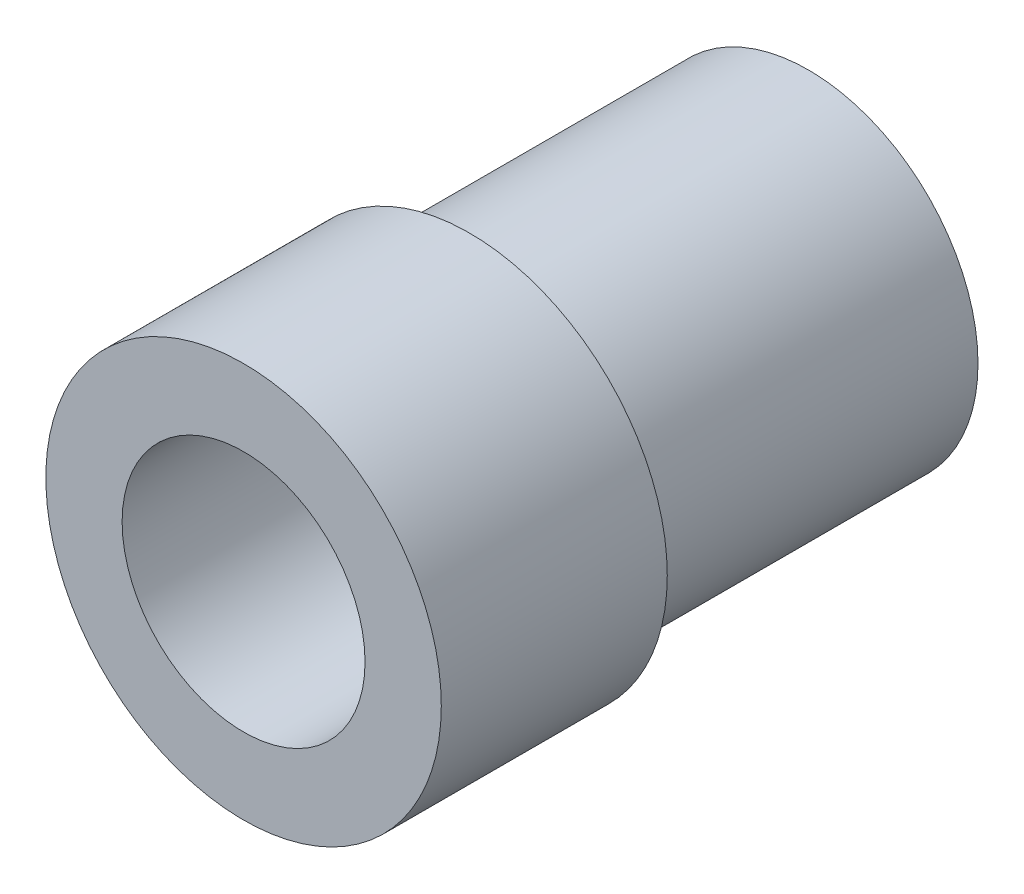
SolidWorks part; units mm, degrees
ref_plane "Top Plane" through (0, 0, 0) normal (0, 0, 1) x (1, 0, 0)
ref_plane "Front Plane" through (0, 0, 0) normal (0, 1, 0) x (1, 0, 0)
ref_plane "Right Plane" through (0, 0, 0) normal (1, 0, 0) x (0, 0, -1)
sketch "Sketch1" plane through (0, 0, 0) normal (0, 0, 1) x (1, 0, 0)
  circle A0 centre (0, 0) radius 3
  circle A1 centre (0, 0) radius 2.15
  dimension "D1" = 6
  dimension "D2" = 4.3
extrude "Boss-Extrude1" add sketch "Sketch1" along normal blind 6
sketch "Sketch2" plane through (0, 0, 6) normal (0, 0, 1) x (1, 0, 0)
  circle A0 centre (0, 0) radius 3.5
  circle A1 centre (0, 0) radius 2.15
  dimension "D1" = 7
extrude "Boss-Extrude2" add sketch "Sketch2" along normal blind 4
